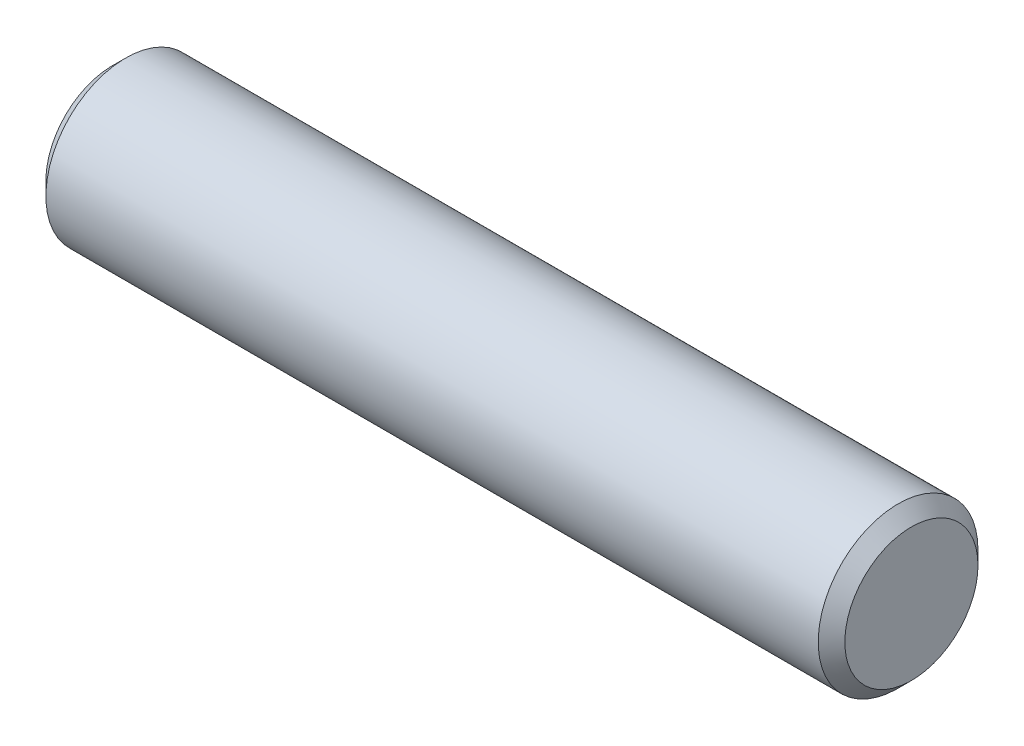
SolidWorks part; units mm, degrees
ref_plane "Face" through (0, 0, 0) normal (0, 0, 1) x (1, 0, 0)
ref_plane "Dessus" through (0, 0, 0) normal (0, 1, 0) x (1, 0, 0)
ref_plane "Droite" through (0, 0, 0) normal (1, 0, 0) x (0, 0, -1)
sketch "Esquisse1" plane through (0, 0, 0) normal (1, 0, 0) x (0, 0, -1)
  circle A0 centre (0, 0) radius 3
  dimension "D1" = 6
extrude "Base-Extrusion" add sketch "Esquisse1" against normal blind 30
chamfer "Chanfrein-0,5" distance 0.5 angle 45
equation "\"7H/8@Esquisse3\" = \"pas@Esquisse2\"*0.75775"
equation "\"H/10@Esquisse3\" = \"pas@Esquisse2\"*0.0866"
equation "\"r@Esquisse3\" = \"pas@Esquisse2\"*0.1443"
